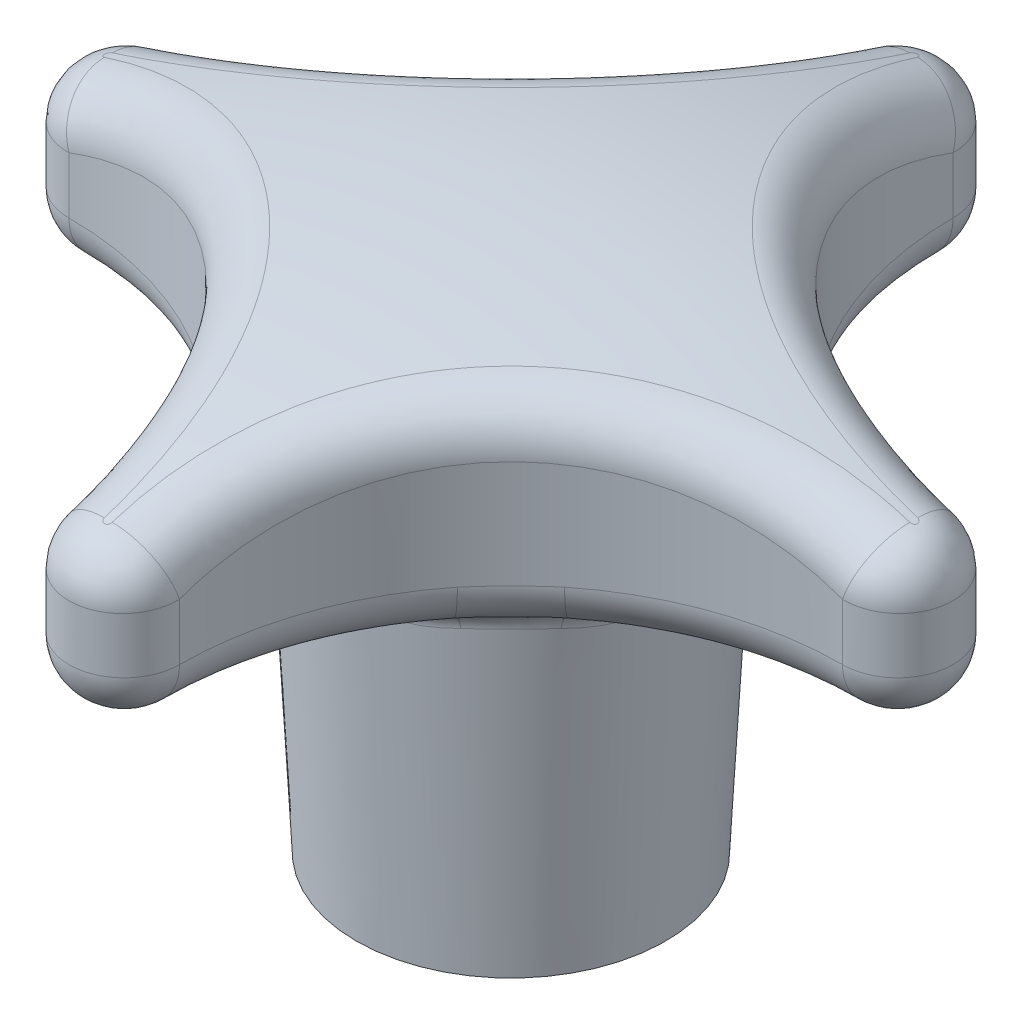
SolidWorks part; units mm, degrees
ref_plane "Front Plane" through (0, 0, 0) normal (0, 0, 1) x (1, 0, 0)
ref_plane "Top Plane" through (0, 0, 0) normal (0, 1, 0) x (1, 0, 0)
ref_plane "Right Plane" through (0, 0, 0) normal (1, 0, 0) x (0, 0, -1)
sketch "Sketch1" plane through (0, 0, 0) normal (0, 1, 0) x (1, 0, 0)
  circle A0 centre (0, 0) radius 7
  dimension "D1" = 14
extrude "Extrude1" add sketch "Sketch1" against normal blind 15
draft "Draft1" type of draft neutral plane draft angle 3 faces to draft 1 parameters "D1"=3
sketch "Sketch2" plane through (0, 0, 0) normal (0, 0, 1) x (1, 0, 0)
  line L0 (0, 0) -> (-20, 0)
  line L1 (-20, 0) -> (-20, 6.5)
  line L2 (0, 0) -> (0, 50000) construction
  line L3 (0, 10) -> (20.2547, 10) construction
  line L4 (0, 0) -> (0, 10)
  arc A0 (0, 10) -> (-20, 6.5) centre (0, -48.8929) ccw
revolve "Revolve1" add sketch "Sketch2" angle 360 about L2
sketch "Sketch4" plane through (0, 0, 0) normal (0, 1, 0) x (1, 0, 0)
  line L0 (0, 0) -> (-50000, 0) construction
  line L1 (0, 0) -> (0, 50000) construction
  line L2 (-17.5, 2.5) -> (-45.9117, 2.5) construction
  line L3 (-2.5, 17.5) -> (-2.5, 40.3224) construction
  arc A0 (0, 20) -> (-2.5, 17.5) centre (0, 17.5) ccw
  arc A1 (-17.5, 2.5) -> (-20, 0) centre (-17.5, 0) ccw
  circle A2 centre (0, 0) radius 20 construction
  arc A3 (-17.5, 2.5) -> (-2.5, 17.5) centre (-17.5, 17.5) ccw
  arc A4 (0, 20) -> (-20, 0) centre (-20, 20) ccw
  point P9 (0, 20)
  point P10 (-20, 0)
  point P13 (-2.5, 17.5)
  point P14 (-17.5, 2.5)
extrude "Extrude3" cut sketch "Sketch4" along normal through all
pattern_circular "CirPattern1" count 4 over 360 about axis through (0, 0, 0) along (0, 1, 0) of "Extrude3"
fillet "Fillet2" radius 2.3333 16 edges at (0, 0, 20) (6.8934, 0, 6.8934) (20, 0, 0) (6.8934, 0, -6.8934) (0, 0, -20) (-6.8934, 0, -6.8934) (-20, 0, 0) (-0.0002, 6.5, 20) (8.4075, 9.1301, 5.57) (20, 6.5, 0.0002) (5.57, 9.1301, -8.4075) (0.0002, 6.5, -20) (-8.4075, 9.1301, -5.57) (-20, 6.5, 0.0002) (-6.8934, 0, 6.8934) (-5.57, 9.1301, 8.4075)
fillet "Fillet3" radius 1.1667 8 edges at (-5.5056, 0, -5.5056) (0, 0, -7.7861) (5.5056, 0, -5.5056) (7.7861, 0, 0) (5.5056, 0, 5.5056) (0, 0, 7.7861) (-5.5056, 0, 5.5056) (-7.7861, 0, 0)
sketch "Sketch6" [suppressed] plane through (0, -30, 0) normal (0, -1, 0) x (1, 0, 0)
  circle A0 centre (0, 0) radius 8
  dimension "D1" = 8
extrude "Extrude5" [suppressed] cut sketch "Sketch6" against normal blind 18
sketch "Sketch7" [suppressed] plane through (0, 0, 0) normal (0, 0, 1) x (1, 0, 0)
  line L0 (0, 2) -> (8, 2)
  line L1 (8, -30) -> (8, 2) construction
  line L2 (8, 2) -> (0, 6.6188)
  line L3 (0, 6.6188) -> (0, 2)
  line L4 (-8, -30) -> (8, -30) construction
revolve "Cut-Revolve1" [suppressed] cut sketch "Sketch7" angle 360 about L3
sketch "Sketch8" [suppressed] plane through (0, -30, 0) normal (0, -1, 0) x (1, 0, 0)
  circle A0 centre (0, 0) radius 8
  dimension "D1" = 8
extrude "Extrude6" [suppressed] cut sketch "Sketch8" against normal blind 13
sketch "Sketch9" [suppressed] plane through (0, -10, 0) normal (0, -1, 0) x (1, 0, 0)
  circle A0 centre (0, 0) radius 8.5
  dimension "D1" = 8.4
extrude "Extrude7" [suppressed] cut sketch "Sketch9" against normal through all
sketch "Sketch10" plane through (0, -15, 0) normal (0, -1, 0) x (1, 0, 0)
  circle A0 centre (0, 0) radius 4
extrude "Extrude8" cut sketch "Sketch10" against normal blind 15
sketch "Sketch11" plane through (0, 0, 0) normal (0, 0, 1) x (1, 0, 0)
  line L0 (3.4, 6.037) -> (3.4, 0)
  line L1 (0, 0) -> (0, -5.4531) construction
  line L2 (3.4, 6.037) -> (0, 8)
  line L3 (0, 8) -> (0, 0)
  line L4 (-4, 0) -> (4, 0) construction
  line L5 (3.4, 0) -> (0, 0)
revolve "Cut-Revolve2" cut sketch "Sketch11" angle 360 about L3
equation "\"D2@Sketch2\" = \"D1@Sketch2\"*.65"
equation "\"D1@Sketch4\" = (\"D3@Sketch2\"*2)/8"
equation "\"D2@Sketch4\" =( \"D3@Sketch2\"*2)/8"
equation "\"D1@Sketch7\" = \"D1@Extrude5\""
equation "\"D1@Fillet3\" = \"D1@Fillet2\"/2"
equation "\"D2@Sketch11\" = \"D1@Sketch10\""
